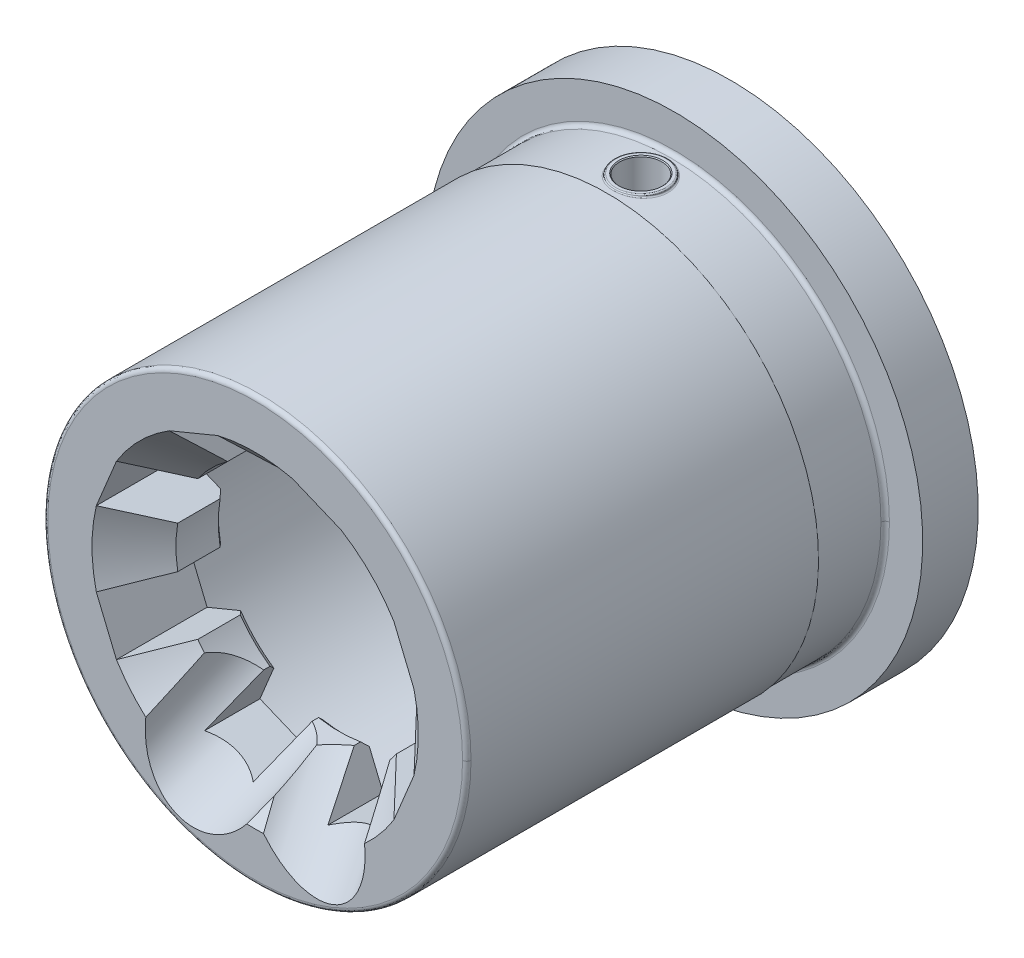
SolidWorks part; units mm, degrees
ref_plane "Front Plane" through (0, 0, 0) normal (0, 0, 1) x (1, 0, 0)
ref_plane "Top Plane" through (0, 0, 0) normal (0, 1, 0) x (1, 0, 0)
ref_plane "Right Plane" through (0, 0, 0) normal (1, 0, 0) x (0, 0, -1)
imported_body "BARRELL EXTENSION"
sketch "Sketch4" plane through (0, 0, 0) normal (0, 1, 0) x (1, 0, 0)
  circle A0 centre (0, -5.3594) radius 1.5685
extrude "Boss-Extrude2" add sketch "Sketch4" along normal blind 12.7
sketch "Sketch5" plane through (0, 0, 0) normal (0, -1, 0) x (1, 0, 0)
  circle A0 centre (0, 5.3594) radius 1.5685
extrude "Cut-Extrude2" cut sketch "Sketch5" against normal blind 12.3825
sketch "Sketch6" plane through (0, 12.7, 0) normal (0, 1, 0) x (1, 0, 0)
  circle A0 centre (0, -5.3594) radius 1.524
  dimension "D1" = 3.048
extrude "Cut-Extrude3" cut sketch "Sketch6" against normal blind 12.3825
sketch "Sketch7" plane through (0, 12.7, 0) normal (0, 1, 0) x (1, 0, 0)
  circle A0 centre (0, -5.3594) radius 1.5685
  circle A1 centre (0, -5.3594) radius 1.27
  dimension "D1" = 2.54
extrude "Boss-Extrude3" add sketch "Sketch7" against normal blind 2.54
fillet "Fillet3" radius 0.0762 1 edges at (0, 12.6111, 6.9279)
fillet "Fillet4" radius 0.0762 1 edges at (0, 12.7, 6.9279)
chamfer "Chamfer1" distance 0.0508 angle 45 1 edges at (0, 12.7, 6.6294)
